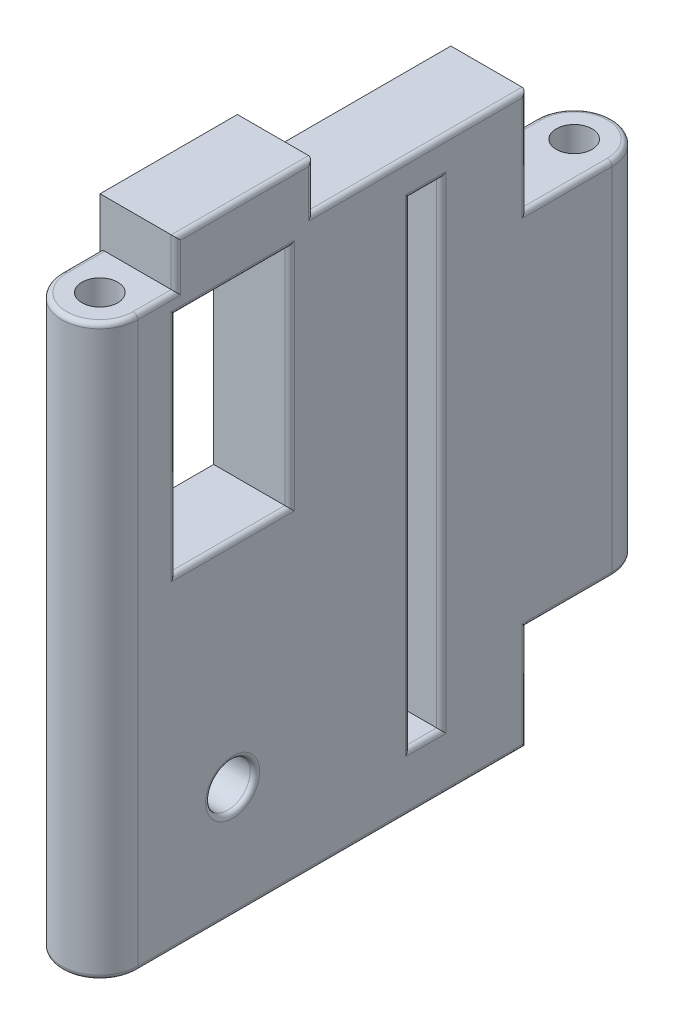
SolidWorks part; units mm, degrees
ref_plane "Front Plane" through (0, 0, 0) normal (0, 0, 1) x (1, 0, 0)
ref_plane "Top Plane" through (0, 0, 0) normal (0, 1, 0) x (1, 0, 0)
ref_plane "Right Plane" through (0, 0, 0) normal (1, 0, 0) x (0, 0, -1)
sketch "Sketch1" plane through (0, 0, 0) normal (0, 1, 0) x (1, 0, 0)
  line L0 (0, 0) -> (0, -50) construction
  line L1 (4, 0) -> (4, -50)
  line L2 (-4, 0) -> (-4, -50)
  arc A0 (4, 0) -> (-4, 0) centre (0, 0) ccw
  arc A1 (-4, -50) -> (4, -50) centre (0, -50) ccw
  point P3 (0, -25)
  dimension "D2" = 8
  dimension "D1" = 50
extrude "body" add sketch "Sketch1" along normal blind 60
sketch "Sketch2" plane through (-4, 0, 0) normal (-1, 0, 0) x (0, 0, 1)
  line L0 (0, 60) -> (50, 60) construction
  line L1 (-13.1259, 49) -> (9, 49)
  line L2 (9, 49) -> (9, 60)
  line L3 (-13.1259, 11) -> (9, 11)
  line L4 (9, 60) -> (-13.1259, 60)
  line L5 (0, 0) -> (50, 0) construction
  line L6 (50, 60) -> (50, 0) construction
  line L7 (25, 60) -> (25, 0) construction
  line L8 (-13.1259, 60) -> (-13.1259, 49)
  line L9 (9, 11) -> (9, 0)
  line L10 (9, 0) -> (-13.1259, 0)
  line L11 (-13.1259, 0) -> (-13.1259, 11)
  line L12 (-4, 60) -> (-4, 0) construction
  line L13 (34, 34.3) -> (46, 34.3)
  line L14 (34, 34.3) -> (34, 58)
  line L15 (34, 58) -> (46, 58)
  line L16 (46, 34.3) -> (46, 58)
  line L17 (40, 58) -> (40, 34.3) construction
  circle A0 centre (40, 11.8464) radius 2.35
  dimension "D7" = 4.7
  dimension "D1" = 12
  dimension "D2" = 11
  dimension "D3" = 13
  dimension "D4" = 23.7
  dimension "D5" = 4
  dimension "D6" = 2
  dimension "D8" = 22.4536
extrude "servoslot" cut sketch "Sketch2" against normal blind 50
sketch "Sketch3" plane through (0, 0, 0) normal (0, -1, 0) x (1, 0, 0)
  circle A0 centre (0, 50) radius 1.8875
  circle A1 centre (0, 0) radius 1.8875
extrude "holeback" cut sketch "Sketch3" against normal through all
sketch "Sketch4" plane through (0, 11, 0) normal (0, -1, 0) x (1, 0, 0)
  circle A0 centre (0, 0) radius 1.6831
sketch "Sketch5" plane through (0, 60, 0) normal (0, 1, 0) x (1, 0, 0)
  line L0 (4, 0) -> (4, -50) construction
  line L1 (4, -31.5) -> (-4, -31.5)
  line L2 (-4, 0) -> (-4, -50) construction
  line L3 (-4, -45.9755) -> (4, -45.9755)
  line L4 (4, -31.5) -> (4, -45.9755)
  line L5 (-4, -31.5) -> (-4, -45.9755)
  line L7 (4, -34) -> (-4, -34) construction
  dimension "D2" = 2.5
extrude "servomountextra" add sketch "Sketch5" along normal blind 5
ref_plane "Plane1" through (0, 30, 0) normal (0, 1, 0) x (1, 0, 0)
sketch "Sketch7" plane through (-4, 0, 0) normal (-1, 0, 0) x (0, 0, 1)
  line L1 (18, 56.3) -> (21.3, 56.3)
  line L2 (18, 56.3) -> (18, 6)
  line L3 (18, 6) -> (21.3, 6)
  line L4 (21.3, 56.3) -> (21.3, 6)
  line L6 (9, 0) -> (9, 11) construction
  line L7 (0, 0) -> (50, 0) construction
  dimension "D1" = 50.3
  dimension "D2" = 3.3
  dimension "D3" = 9
  dimension "D4" = 6
extrude "gearsupportslot" cut sketch "Sketch7" against normal blind 10
fillet "Fillet5" radius 0.5 27 edges at (4, 31.15, 21.3) (4, 6, 19.65) (4, 31.15, 18) (4, 56.3, 19.65) (4, 46.15, 46) (4, 34.3, 40) (4, 46.15, 34) (4, 58, 40) (0, 60, 54) (-4, 49, 4.5) (0, 49, -4) (-4, 11, 4.5) (0, 11, -4) (-4, 0, 29.5) (0, 0, 54) (4, 65, 38.7378) (4, 54.5, 9) (4, 49, 4.5) (4, 11, 4.5) (4, 5.5, 9) (4, 0, 29.5) (4, 11.8464, 42.35)
equation "\"linkagehole.125\"= .125in + .6mm"
equation "\"D1@Sketch3\"= \"linkagehole.125\""
